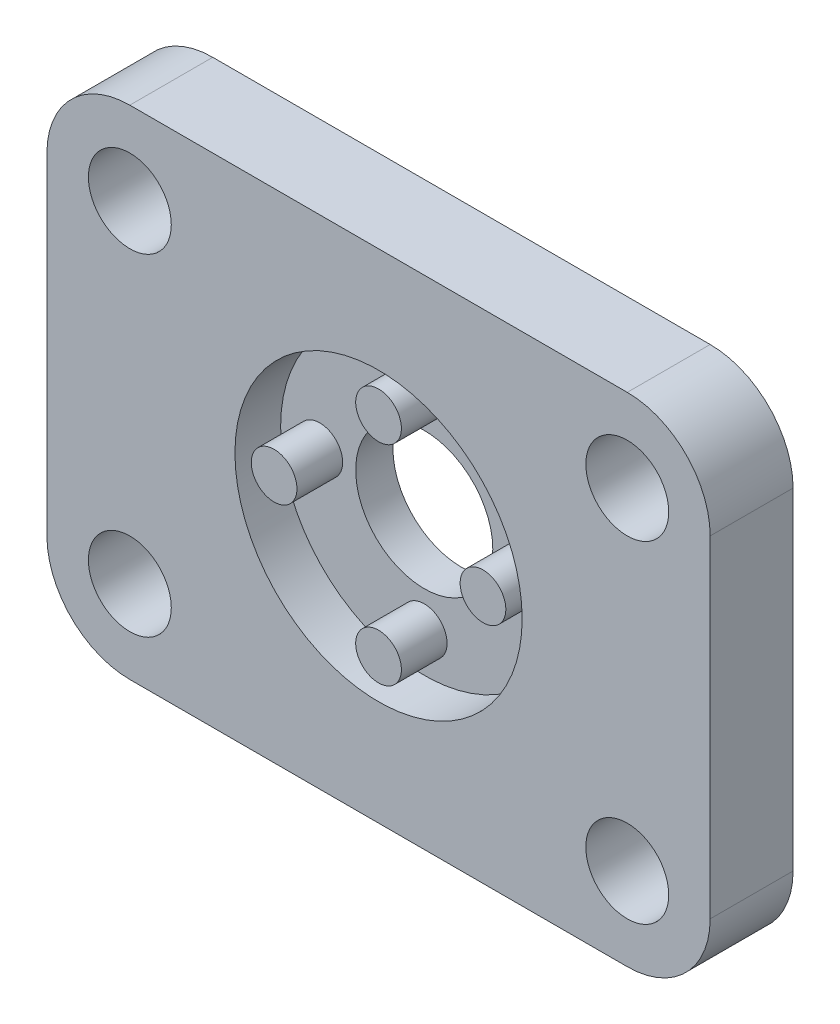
SolidWorks part; units mm, degrees
ref_plane "Front Plane" through (0, 0, 0) normal (0, 0, 1) x (1, 0, 0)
ref_plane "Top Plane" through (0, 0, 0) normal (0, 1, 0) x (1, 0, 0)
ref_plane "Right Plane" through (0, 0, 0) normal (1, 0, 0) x (0, 0, -1)
sketch "Sketch1" plane through (0, 0, 0) normal (0, 0, 1) x (1, 0, 0)
  line L1 (0, 0) -> (50.8, 0)
  line L2 (0, 0) -> (0, 38.1)
  line L3 (0, 38.1) -> (50.8, 38.1)
  line L4 (50.8, 0) -> (50.8, 38.1)
  dimension "D1" = 38.1
  dimension "D2" = 50.8
extrude "Boss-Extrude1" add sketch "Sketch1" along normal blind 6.35
sketch "Sketch2" plane through (0, 0, 6.35) normal (0, 0, 1) x (1, 0, 0)
  line L0 (25.4, 38.1) -> (25.4, 0) construction
  line L1 (50.8, 38.1) -> (0, 38.1) construction
  line L2 (0, 0) -> (50.8, 0) construction
  line L3 (0, 19.05) -> (50.8, 19.05) construction
  line L4 (0, 38.1) -> (0, 0) construction
  line L5 (50.8, 0) -> (50.8, 38.1) construction
  circle A0 centre (25.4, 19.05) radius 11
  circle A1 centre (25.4, 27.05) radius 1.75
  circle A2 centre (33.4, 19.05) radius 1.75
  circle A3 centre (25.4, 11.05) radius 1.75
  circle A4 centre (17.4, 19.05) radius 1.75
  dimension "D1" = 22
  dimension "D3" = 3.5
  dimension "D2" = 8
extrude "Cut-Extrude1" cut sketch "Sketch2" against normal blind 3.5
sketch "Sketch3" plane through (0, 0, 2.85) normal (0, 0, 1) x (1, 0, 0)
  circle A0 centre (25.4, 19.05) radius 5.25
  circle A1 centre (25.4, 19.05) radius 11 construction
  dimension "D1" = 10.5
extrude "Cut-Extrude2" cut sketch "Sketch3" against normal blind 3.5
sketch "Sketch4" plane through (0, 0, 6.35) normal (0, 0, 1) x (1, 0, 0)
  line L0 (50.8, 38.1) -> (0, 38.1) construction
  line L1 (6.35, 31.75) -> (44.45, 31.75) construction
  line L2 (6.35, 31.75) -> (6.35, 6.35) construction
  line L3 (6.35, 6.35) -> (44.45, 6.35) construction
  line L4 (44.45, 31.75) -> (44.45, 6.35) construction
  line L5 (0, 0) -> (50.8, 0) construction
  line L6 (0, 38.1) -> (0, 0) construction
  line L7 (50.8, 0) -> (50.8, 38.1) construction
  circle A0 centre (6.35, 31.75) radius 3.175
  circle A1 centre (6.35, 6.35) radius 3.175
  circle A2 centre (44.45, 31.75) radius 3.175
  circle A3 centre (44.45, 6.35) radius 3.175
  dimension "D5" = 6.35
  dimension "D1" = 6.35
  dimension "D2" = 6.35
  dimension "D3" = 6.35
  dimension "D4" = 6.35
extrude "Cut-Extrude3" cut sketch "Sketch4" against normal through all
fillet "Fillet1" radius 6.35 4 edges at (50.8, 38.1, 3.175) (50.8, 0, 3.175) (0, 0, 3.175) (0, 38.1, 3.175)
